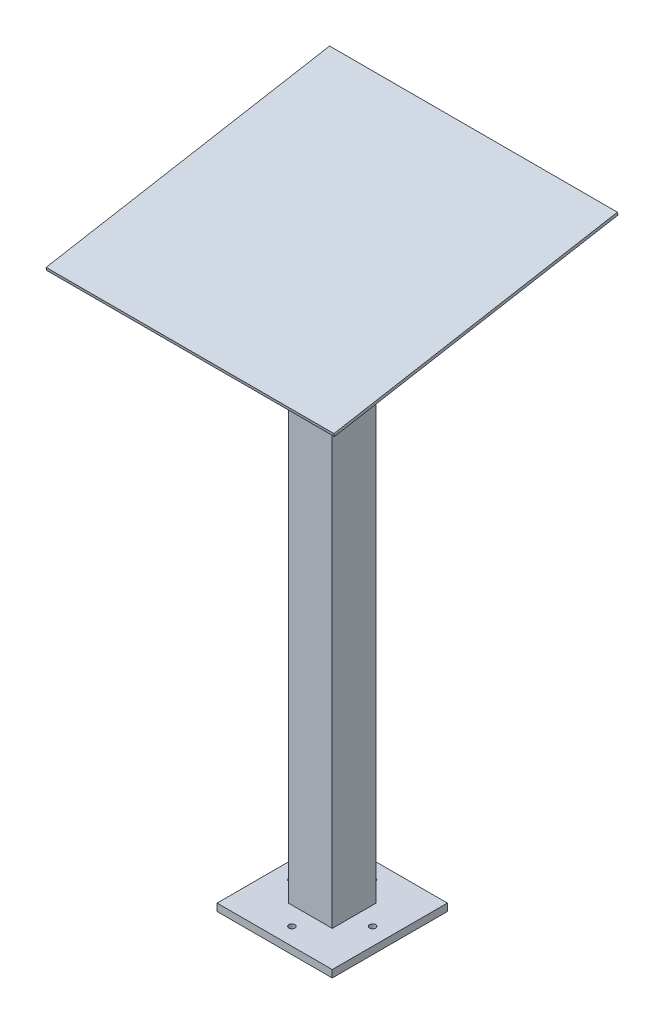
SolidWorks part; units mm, degrees
ref_plane "Front Plane" through (0, 0, 0) normal (0, 0, 1) x (1, 0, 0)
ref_plane "Top Plane" through (0, 0, 0) normal (0, 1, 0) x (1, 0, 0)
ref_plane "Right Plane" through (0, 0, 0) normal (1, 0, 0) x (0, 0, -1)
sketch "Sketch1" plane through (0, 0, 0) normal (0, 1, 0) x (1, 0, 0)
  line L0 (-100, 100) -> (100, -100) construction
  line L1 (-100, 100) -> (100, 100)
  line L2 (-100, 100) -> (-100, -100)
  line L3 (-100, -100) -> (100, -100)
  line L4 (100, 100) -> (100, -100)
  line L5 (0, 70) -> (70, 0) construction
  line L6 (0, 70) -> (-70, 0) construction
  line L7 (-70, 0) -> (0, -70) construction
  line L8 (70, 0) -> (0, -70) construction
  line L10 (-70, 0) -> (70, 0) construction
  circle A0 centre (0, 70) radius 5.25
  circle A1 centre (70, 0) radius 5.25
  circle A2 centre (0, -70) radius 5.25
  circle A3 centre (-70, 0) radius 5.25
  circle A4 centre (0, 0) radius 70 construction
  dimension "D3" = 10.5
  dimension "D1" = 140
  dimension "D2" = 200
extrude "Boss-Extrude1" add sketch "Sketch1" along normal blind 12.7
sketch "Sketch2" plane through (0, 12.7, 0) normal (0, 1, 0) x (1, 0, 0)
  line L0 (-38.1, -38.1) -> (38.1, 38.1)
  line L1 (-38.1, 38.1) -> (38.1, 38.1)
  line L2 (-38.1, 38.1) -> (-38.1, -38.1)
  line L3 (-38.1, -38.1) -> (38.1, -38.1)
  line L4 (38.1, 38.1) -> (38.1, -38.1)
  dimension "D1" = 76.2
extrude "Boss-Extrude2" add sketch "Sketch2" along normal blind 1000 contours L4 L0 L3 | L1 L2 L0
sketch "Sketch3" plane through (-38.1, 0, 0) normal (-1, 0, 0) x (0, 0, 1)
  line L0 (-38.1, 1012.7) -> (38.1, 999.2639)
  line L1 (38.1, 1012.7) -> (38.1, 12.7) construction
  line L2 (-38.1, 1012.7) -> (38.1, 1012.7) construction
  line L3 (-38.1, 1012.7) -> (38.1, 1012.7)
  line L4 (38.1, 1012.7) -> (38.1, 999.2639)
  dimension "D1" = 10
extrude "Cut-Extrude1" cut sketch "Sketch3" against normal through all
sketch "Sketch4" plane through (0, 975.6479, 172.033) normal (0, 0.9848, 0.1736) x (1, 0, 0)
  line L0 (-250, 424.6869) -> (250, -75.3131)
  line L1 (-250, 424.6869) -> (250, 424.6869)
  line L2 (-250, 424.6869) -> (-250, -75.3131)
  line L3 (-250, -75.3131) -> (250, -75.3131)
  line L4 (250, 424.6869) -> (250, -75.3131)
  line L5 (38.1, 213.3747) -> (-38.1, 135.9992) construction
  point P7 (0, 174.6869)
  dimension "D1" = 500
extrude "Boss-Extrude3" add sketch "Sketch4" along normal blind 5 separate body contours L2 L3 L0 M4 M7 M6 | L4 L1 L0 M6 M5 M4 | L5 L0 M6 | L5 L0 M5 M6 | L5 L0 M4 | L0 L5 M7 M4
